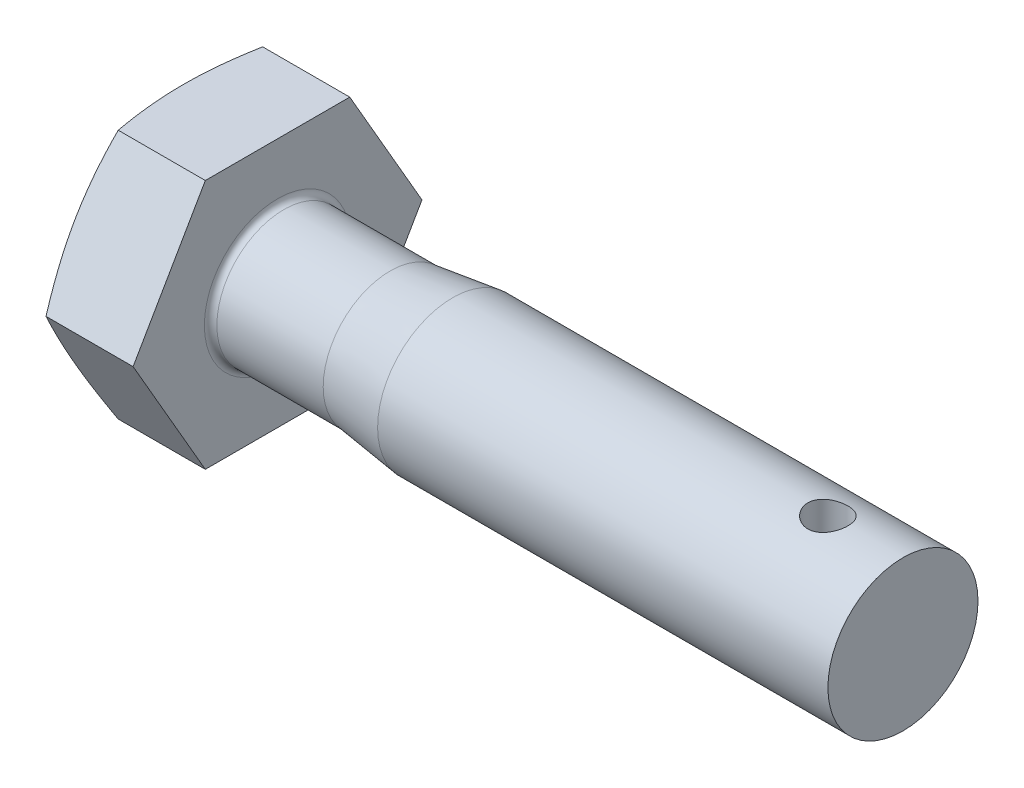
SolidWorks part; units mm, degrees
ref_plane "Front" through (0, 0, 0) normal (0, 0, 1) x (1, 0, 0)
ref_plane "Top" through (0, 0, 0) normal (0, 1, 0) x (1, 0, 0)
ref_plane "Right" through (0, 0, 0) normal (1, 0, 0) x (0, 0, -1)
sketch "Sketch1" plane through (0, 0, 0) normal (1, 0, 0) x (0, 0, -1)
  line L1 (2.8868, -5) -> (5.7735, 0)
  line L2 (5.7735, 0) -> (2.8868, 5)
  line L3 (2.8868, 5) -> (-2.8868, 5)
  line L4 (-2.8868, 5) -> (-5.7735, 0)
  line L5 (-5.7735, 0) -> (-2.8868, -5)
  line L6 (-2.8868, -5) -> (2.8868, -5)
  circle A0 centre (0, 0) radius 5 construction
  dimension "s" = 10
extrude "BaseHead" add sketch "Sketch1" along normal blind 4
ref_plane "Plane1" through (11, 0, 0) normal (1, 0, 0) x (0, 0, -1)
sketch "Sketch2" plane through (4, 0, 0) normal (1, 0, 0) x (0, 0, -1)
  circle A0 centre (0, 0) radius 3
  dimension "d" = 6
extrude "BaseBody" add sketch "Sketch2" along normal blind 25
sketch "Sketch3" plane through (3.1612, 0, 2.6123) normal (0, 1, 0) x (0, 0, -1)
  line L0 (2.6123, 2.0714) -> (2.6123, -1.5224) construction
  line L2 (8.3858, 3.1612) -> (8.3858, 2.6431)
  line L3 (8.3858, 2.6431) -> (6.9623, 3.1612)
  line L5 (6.9623, 3.1612) -> (8.3858, 3.1612)
  dimension "D1" = 20
  dimension "dw" = 8.7
revolve "HeadChamfer" cut sketch "Sketch3" angle 360 about L0
sketch "Sketch4" plane through (0, 0, 0) normal (1, 0, 0) x (0, 0, -1)
  circle A0 centre (0, 0) radius 3.4
  dimension "da" = 6.8
extrude "Cut-Extrude1" cut sketch "Sketch4" along normal blind 0.8
sketch "Sketch5" plane through (-2.9296, 0, 7.9296) normal (0, 1, 0) x (0, 0, -1)
  line L0 (7.9296, -2.9296) -> (7.9296, -19.1832) construction
  line L1 (13.7031, -6.9296) -> (10.8164, -6.9296) construction
  line L2 (10.9296, -13.9296) -> (10.6046, -11.4296)
  line L3 (10.9296, -2.9296) -> (10.9296, -19.1832) construction
  line L4 (10.6046, -11.4296) -> (10.6046, -6.9296)
  line L5 (10.9296, -31.9296) -> (10.9296, -6.9296) construction
  line L6 (10.6046, -6.9296) -> (13.2796, -6.9296)
  line L7 (13.2796, -6.9296) -> (13.2796, -13.9296)
  line L8 (13.2796, -13.9296) -> (10.9296, -13.9296)
  line L9 (4.9296, -31.9296) -> (10.9296, -31.9296) construction
  dimension "D1" = 3
  dimension "ds" = 5.35
  dimension "x" = 2.5
  dimension "D3" = 18
  dimension "D4" = 10.7
revolve "Cut-Revolve1" cut sketch "Sketch5" angle 360 about L0
fillet "HeadFillet" radius 0.25 1 edges at (4, 0, 2.675)
sketch "Sketch6" plane through (0, 0, 0) normal (0, 1, 0) x (1, 0, 0)
  line L0 (4, -2.8868) -> (4, -5.7735) construction
  circle A0 centre (26, 0) radius 0.8
  dimension "d1" = 1.6
  dimension "lh" = 22
extrude "Hole" cut sketch "Sketch6" against normal through all and the other way through all
equation "\"D1@Cut-Extrude1\" = 0.2 * \"k@BaseHead\""
equation "\"b@ThreadCosmetic1\" = \"l@BaseBody\" - \"lg@Plane1\""
equation "\"D4@Sketch5\" = 2 * \"ds@Sketch5\""
equation "\"D3@Sketch5\" = \"l@BaseBody\" - \"lg@Plane1\""
